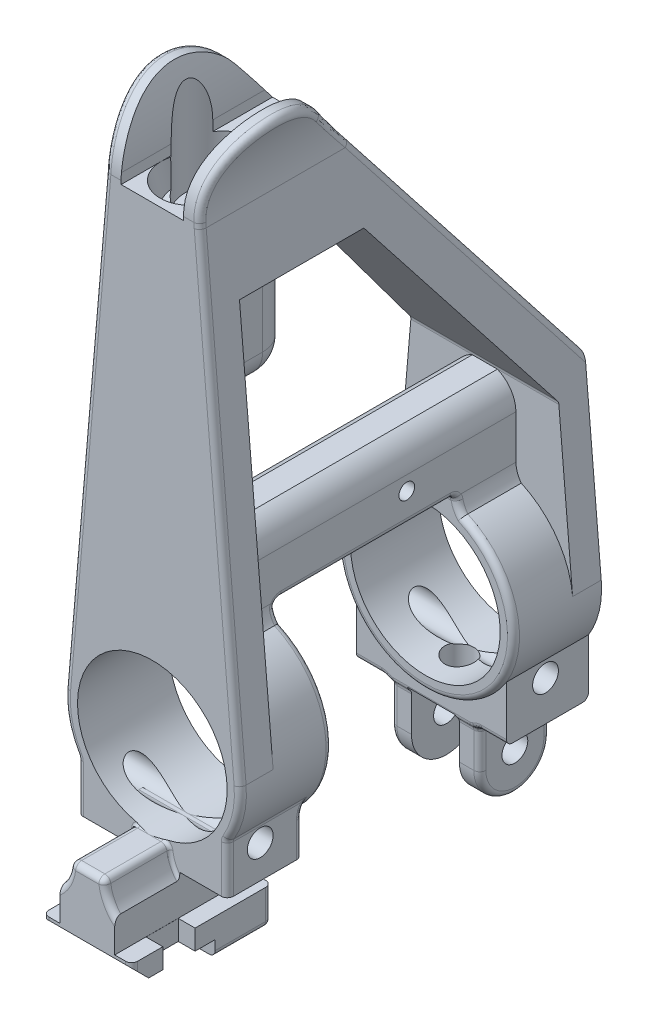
SolidWorks part; units mm, degrees
ref_plane "Front Plane" through (0, 0, 0) normal (0, 0, 1) x (1, 0, 0)
ref_plane "Top Plane" through (0, 0, 0) normal (0, 1, 0) x (1, 0, 0)
ref_plane "Right Plane" through (0, 0, 0) normal (1, 0, 0) x (0, 0, -1)
imported_body "Imported1"
sketch "Sketch1" plane through (0, 0, 0) normal (1, 0, 0) x (0, 0, -1)
  line L0 (44.8056, -12.7) -> (44.8056, -18.1292)
  line L1 (35.9156, -18.1292) -> (35.9156, -12.7)
  line L2 (45.6726, -12.7) -> (35.4228, -12.7) construction
  line L3 (35.9156, -12.7) -> (44.8056, -12.7)
  arc A0 (44.8056, -18.1292) -> (35.9156, -18.1292) centre (40.3606, -18.1292) cw
  arc A1 (35.9156, -18.1292) -> (44.8056, -18.1292) centre (40.3606, -18.1292) ccw construction
extrude "Cut-Extrude1" cut sketch "Sketch1" against normal up to surface and the other way up to surface contours A0 L0 L3 L1
